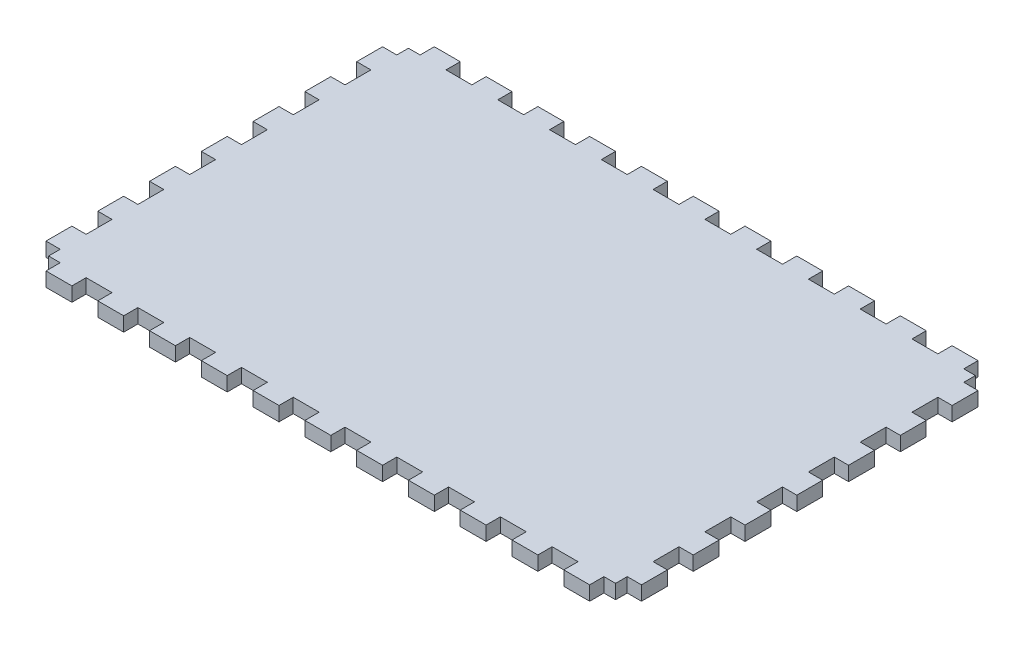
SolidWorks part; units mm, degrees
ref_plane "Front Plane" through (0, 0, 0) normal (0, 0, 1) x (1, 0, 0)
ref_plane "Top Plane" through (0, 0, 0) normal (0, 1, 0) x (1, 0, 0)
ref_plane "Right Plane" through (0, 0, 0) normal (1, 0, 0) x (0, 0, -1)
sketch "Sketch1" plane through (0, 0, 0) normal (0, 1, 0) x (1, 0, 0)
  line L1 (-58.42, 38.1) -> (58.42, 38.1)
  line L2 (-58.42, 38.1) -> (-58.42, -38.1)
  line L3 (-58.42, -38.1) -> (58.42, -38.1)
  line L4 (58.42, 38.1) -> (58.42, -38.1)
  line L5 (-58.42, 38.1) -> (58.42, -38.1) construction
  line L6 (-58.42, -38.1) -> (58.42, 38.1) construction
  point P0 (0, 0)
  dimension "D1" = 76.2
  dimension "D2" = 116.84
extrude "Boss-Extrude1" add sketch "Sketch1" along normal blind 2.794
other "Cavity1"
other "Part1box<3>@MyBox1"
other "boxside1<1>@MyBox"
other "backpart<1>@MyBox1"
other "boxside1<2>@MyBox"
